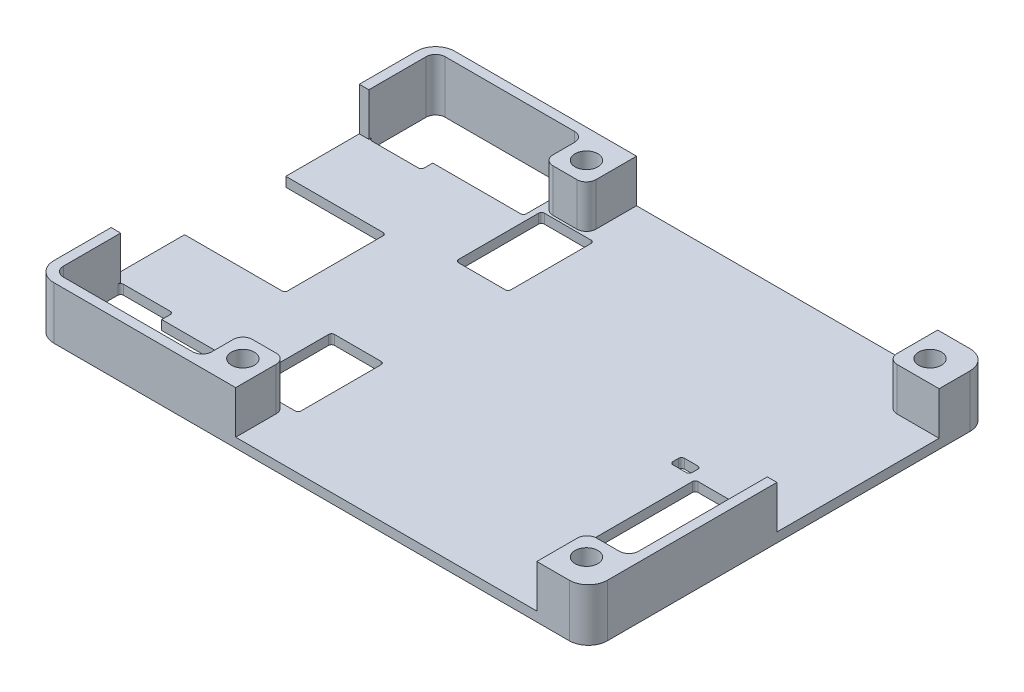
SolidWorks part; units mm, degrees
ref_plane "前视基准面" through (0, 0, 0) normal (0, 0, 1) x (1, 0, 0)
ref_plane "上视基准面" through (0, 0, 0) normal (0, 1, 0) x (1, 0, 0)
ref_plane "右视基准面" through (0, 0, 0) normal (1, 0, 0) x (0, 0, -1)
sketch "草图1" plane through (0, 0, 0) normal (0, 1, 0) x (1, 0, 0)
  line L1 (-28, 20) -> (28, 20)
  line L2 (-28, 20) -> (-28, -20)
  line L3 (-28, -20) -> (28, -20)
  line L4 (28, 20) -> (28, -20)
  line L5 (-28, 20) -> (28, -20) construction
  line L6 (-28, -20) -> (28, 20) construction
  point P0 (0, 0)
  dimension "D1" = 40
  dimension "D2" = 56
extrude "凸台-拉伸1" add sketch "草图1" along normal blind 1
fillet "圆角1" radius 1 4 edges at (-28, 0.5, 20) (-28, 0.5, -20) (28, 0.5, -20) (28, 0.5, 20)
sketch "草图2" plane through (0, 0, 0) normal (0, 1, 0) x (1, 0, 0)
  line L0 (-27, -20) -> (27, -20) construction
  line L1 (-10.2, 18) -> (25.8, 18) construction
  line L2 (-10.2, 18) -> (-10.2, -18) construction
  line L3 (-10.2, -18) -> (25.8, -18) construction
  line L4 (25.8, 18) -> (25.8, -18) construction
  line L5 (-10.2, 18) -> (25.8, -18) construction
  line L6 (-10.2, -18) -> (25.8, 18) construction
  line L7 (28, -19) -> (28, 19) construction
  circle A0 centre (-10.2, 18) radius 1.2
  circle A1 centre (25.8, 18) radius 1.2
  circle A2 centre (25.8, -18) radius 1.2
  circle A3 centre (-10.2, -18) radius 1.2
  point P0 (7.8, 0)
  point P19 (7.8, 0)
  dimension "D4" = 2.4
  dimension "D1" = 36
  dimension "D2" = 2
  dimension "D3" = 2.2
  dimension "D5" = 4
extrude "切除-拉伸1" cut sketch "草图2" along normal up to surface (1 mm away)
sketch "草图3" plane through (0, 0, 0) normal (0, 1, 0) x (1, 0, 0)
  line L8 (-29, 19) -> (-29, -19)
  line L9 (-27, -21) -> (27, -21)
  line L10 (29, -19) -> (29, 19)
  line L11 (27, 21) -> (-27, 21)
  line L12 (-29, 19) -> (-29, -19)
  line L13 (-27, -21) -> (27, -21)
  line L14 (29, -19) -> (29, 19)
  line L15 (27, 21) -> (-27, 21)
  line L16 (-28, 19) -> (-28, -19)
  line L17 (-27, -20) -> (27, -20)
  line L18 (28, -19) -> (28, 19)
  line L19 (27, 20) -> (-27, 20)
  line L20 (-28, 19) -> (-28, -19)
  line L21 (-27, -20) -> (27, -20)
  line L22 (28, -19) -> (28, 19)
  line L23 (27, 20) -> (-27, 20)
  arc A8 (-29, -19) -> (-27, -21) centre (-27, -19) ccw
  arc A9 (27, -21) -> (29, -19) centre (27, -19) ccw
  arc A10 (29, 19) -> (27, 21) centre (27, 19) ccw
  arc A11 (-27, 21) -> (-29, 19) centre (-27, 19) ccw
  arc A12 (-29, -19) -> (-27, -21) centre (-27, -19) ccw
  arc A13 (27, -21) -> (29, -19) centre (27, -19) ccw
  arc A14 (29, 19) -> (27, 21) centre (27, 19) ccw
  arc A15 (-27, 21) -> (-29, 19) centre (-27, 19) ccw
  arc A16 (-28, -19) -> (-27, -20) centre (-27, -19) ccw
  arc A17 (27, -20) -> (28, -19) centre (27, -19) ccw
  arc A18 (28, 19) -> (27, 20) centre (27, 19) ccw
  arc A19 (-27, 20) -> (-28, 19) centre (-27, 19) ccw
  arc A20 (-28, -19) -> (-27, -20) centre (-27, -19) ccw
  arc A21 (27, -20) -> (28, -19) centre (27, -19) ccw
  arc A22 (28, 19) -> (27, 20) centre (27, 19) ccw
  arc A23 (-27, 20) -> (-28, 19) centre (-27, 19) ccw
  dimension "D1" = 1
  dimension "D2" = 0
extrude "凸台-拉伸2" add sketch "草图3" along normal blind 5.5
sketch "草图5" plane through (0, 1, 0) normal (0, 1, 0) x (1, 0, 0)
  line L0 (28, -19) -> (28, 19) construction
  line L1 (23.6, 20.25) -> (28, 20.25)
  line L2 (23.6, 20.25) -> (23.6, 15.75)
  line L3 (23.6, 15.75) -> (28, 15.75)
  line L4 (28, 20.25) -> (28, 15.75)
  line L5 (23.6, 20.25) -> (28, 15.75) construction
  line L6 (23.6, 15.75) -> (28, 20.25) construction
  line L9 (23.6, -20.25) -> (28, -20.25)
  line L10 (23.6, -20.25) -> (23.6, -15.75)
  line L11 (23.6, -15.75) -> (28, -15.75)
  line L12 (28, -20.25) -> (28, -15.75)
  line L13 (23.6, -20.25) -> (28, -15.75) construction
  line L14 (23.6, -15.75) -> (28, -20.25) construction
  line L16 (-12.45, -20.25) -> (-7.95, -20.25)
  line L17 (-12.45, -20.25) -> (-12.45, -15.75)
  line L18 (-12.45, -15.75) -> (-7.95, -15.75)
  line L19 (-7.95, -20.25) -> (-7.95, -15.75)
  line L20 (-12.45, -20.25) -> (-7.95, -15.75) construction
  line L21 (-12.45, -15.75) -> (-7.95, -20.25) construction
  line L22 (-12.45, 20.25) -> (-7.95, 20.25)
  line L23 (-12.45, 20.25) -> (-12.45, 15.75)
  line L24 (-12.45, 15.75) -> (-7.95, 15.75)
  line L25 (-7.95, 20.25) -> (-7.95, 15.75)
  line L26 (-12.45, 20.25) -> (-7.95, 15.75) construction
  line L27 (-12.45, 15.75) -> (-7.95, 20.25) construction
  circle A0 centre (-10.2, -18) radius 1.2 construction
  circle A1 centre (25.8, -18) radius 1.2 construction
  circle A2 centre (25.8, 18) radius 1.2 construction
  circle A3 centre (-10.2, 18) radius 1.2 construction
  circle A4 centre (-10.2, -18) radius 1.2
  circle A5 centre (25.8, -18) radius 1.2
  circle A6 centre (25.8, 18) radius 1.2
  circle A7 centre (-10.2, 18) radius 1.2
  dimension "D1" = 4.5
  dimension "D2" = 4.5
  dimension "D3" = 4.5
  dimension "D4" = 4.5
extrude "凸台-拉伸3" add sketch "草图5" along normal up to surface (4.5 mm away)
fillet "圆角2" radius 1 14 edges at (-12.45, 3.25, 20) (-7.95, 3.25, 20) (-12.45, 3.25, 15.75) (-7.95, 3.25, 15.75) (-12.45, 3.25, -20) (-12.45, 3.25, -15.75) (-7.95, 3.25, -15.75) (-7.95, 3.25, -20) (23.6, 3.25, 20) (23.6, 3.25, 15.75) (28, 3.25, 15.75) (28, 3.25, -15.75) (23.6, 3.25, -15.75) (23.6, 3.25, -20)
sketch "草图6" plane through (0, 5.5, 0) normal (0, 1, 0) x (1, 0, 0)
  line L0 (-7.95, 16.75) -> (-7.95, 19) construction
  line L1 (-7.95, 17.875) -> (23.6, 17.875)
  line L2 (-7.95, 17.875) -> (-7.95, 21)
  line L3 (-7.95, 21) -> (23.6, 21)
  line L4 (23.6, 17.875) -> (23.6, 21)
  line L5 (27, 21) -> (-27, 21) construction
  line L6 (23.6, 19) -> (23.6, 16.75) construction
  line L7 (23.6, -16.75) -> (23.6, -19) construction
  line L8 (23.6, -17.875) -> (-7.95, -17.875)
  line L9 (23.6, -17.875) -> (23.6, -21)
  line L10 (23.6, -21) -> (-7.95, -21)
  line L11 (-7.95, -17.875) -> (-7.95, -21)
  line L12 (-27, -21) -> (27, -21) construction
  line L13 (-7.95, -19) -> (-7.95, -16.75) construction
  line L14 (-28, 19) -> (-28, -19) construction
  line L15 (-30, 13) -> (-26, 13)
  line L16 (-30, 13) -> (-30, -13)
  line L17 (-30, -13) -> (-26, -13)
  line L18 (-26, 13) -> (-26, -13)
  line L19 (-30, 13) -> (-26, -13) construction
  line L20 (-30, -13) -> (-26, 13) construction
  line L21 (29, -19) -> (29, 19) construction
  line L22 (27, 15.75) -> (29, 15.75)
  line L23 (27, 15.75) -> (27, -1.25)
  line L24 (27, -1.25) -> (29, -1.25)
  line L25 (29, 15.75) -> (29, -1.25)
  point P20 (-28, 0)
  point P36 (27, 15.75)
  dimension "D1" = 26
  dimension "D2" = 4
  dimension "D3" = 17
extrude "切除-拉伸2" cut sketch "草图6" against normal up to surface (4.5 mm away)
sketch "草图7" plane through (0, 0, 0) normal (0, -1, 0) x (1, 0, 0)
  line L2 (-28, 13) -> (-28, 19) construction
  line L3 (-18.503, 0) -> (0, 0) construction
sketch_block_instance "块1-1"
sketch_block "块1" parameters "D16"=1, "D14"=1, "D1"=10.5, "D2"=9, "D3"=5.5, "D4"=9, "D5"=5.5, "D6"=5.3, "D7"=2.6, "D8"=1.4, "D9"=8, "D10"=1.2, "D11"=2, "D12"=5.5, "D13"=5.5, "D15"=14.9162, "D17"=4.8
extrude "切除-拉伸3" cut sketch "草图7" against normal blind 10
fillet "圆角3" radius 0.3 26 edges at (-13, 0.5, -14.2) (-22.5, 0.5, -13) (-28, 0.5, -13) (-28, 0.5, 13) (-22.5, 0.5, 13) (-13, 0.5, 14.2) (-12.4093, 0.5, 6.5) (-12.4093, 0.5, 15.5) (-6.9093, 0.5, 15.5) (-6.9093, 0.5, 6.5) (-12.4093, 0.5, -15.5) (-12.4093, 0.5, -6.5) (-6.9093, 0.5, -6.5) (-6.9093, 0.5, -15.5) (20.0007, 0.5, 14.3) (22.7007, 0.5, 15.7) (25.4007, 0.5, 15.7) (28.0007, 2.75, 14.3) (28.0007, 0.5, 0.8) (20.0007, 0.5, 0.8) (-18.503, 0.5, 5.3) (-18.503, 0.5, -5.3) (17.1653, 0.5, -0.6) (17.1653, 0.5, 0.6) (19.1653, 0.5, 0.6) (19.1653, 0.5, -0.6)
sketch "草图8" plane through (0, 0, 0) normal (0, -1, 0) x (1, 0, 0)
sketch_block_instance "块2-1"
sketch_block "块2"
extrude "切除-拉伸4" cut sketch "草图8" against normal blind 0.3
